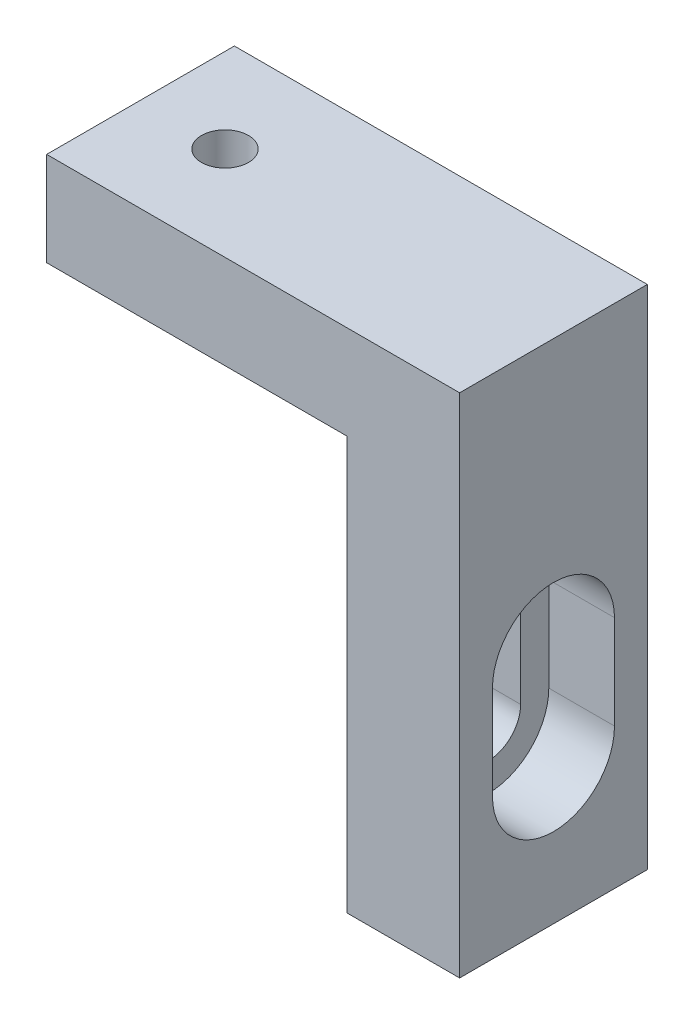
SolidWorks part; units mm, degrees
ref_plane "前视基准面" through (0, 0, 0) normal (0, 0, 1) x (1, 0, 0)
ref_plane "上视基准面" through (0, 0, 0) normal (0, 1, 0) x (1, 0, 0)
ref_plane "右视基准面" through (0, 0, 0) normal (1, 0, 0) x (0, 0, -1)
sketch "草图1" plane through (0, 0, 0) normal (0, 0, 1) x (1, 0, 0)
  line L0 (16, 0) -> (16, 22)
  line L1 (22, 0) -> (22, 27)
  line L2 (0, 22) -> (0, 27)
  line L3 (0, 22) -> (16, 22)
  line L4 (0, 27) -> (22, 27)
  line L5 (16, 0) -> (22, 0)
extrude "凸台-拉伸1" add sketch "草图1" along normal blind 10
sketch "草图2" plane through (22, 0, 0) normal (1, 0, 0) x (0, 0, -1)
  line L0 (-6.75, 7.5) -> (-6.75, 12.5)
  line L1 (-3.25, 7.5) -> (-3.25, 12.5)
  arc A0 (-6.75, 7.5) -> (-3.25, 7.5) centre (-5, 7.5) ccw
  arc A1 (-3.25, 12.5) -> (-6.75, 12.5) centre (-5, 12.5) ccw
extrude "切除-拉伸1" cut sketch "草图2" against normal blind 10
sketch "草图3" plane through (22, 0, 0) normal (1, 0, 0) x (0, 0, -1)
  line L0 (-8.25, 7.5) -> (-8.25, 12.5)
  line L1 (-1.75, 7.5) -> (-1.75, 12.5)
  arc A0 (-8.25, 7.5) -> (-1.75, 7.5) centre (-5, 7.5) ccw
  arc A1 (-1.75, 12.5) -> (-8.25, 12.5) centre (-5, 12.5) ccw
extrude "切除-拉伸2" cut sketch "草图3" against normal blind 3.5
sketch "草图4" plane through (0, 27, 0) normal (0, 1, 0) x (1, 0, 0)
  circle A0 centre (4.5, -5) radius 1.25
extrude "切除-拉伸3" cut sketch "草图4" against normal through all
